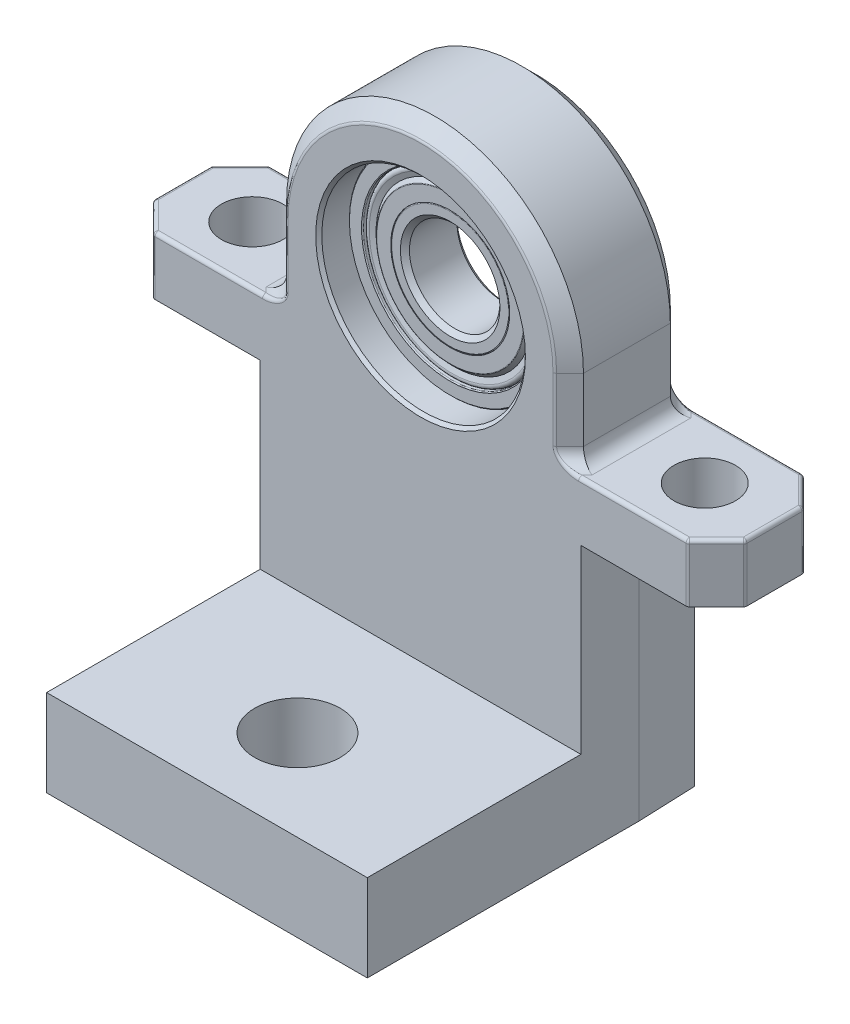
SolidWorks part; units mm, degrees
ref_plane "Front Plane" through (0, 0, 0) normal (0, 0, 1) x (1, 0, 0)
ref_plane "Top Plane" through (0, 0, 0) normal (0, 1, 0) x (1, 0, 0)
ref_plane "Right Plane" through (0, 0, 0) normal (1, 0, 0) x (0, 0, -1)
sketch "Sketch1" plane through (0, 0, 0) normal (0, 0, 1) x (1, 0, 0)
  line L0 (20.828, 0) -> (20.828, -10.922)
  line L1 (20.828, -10.922) -> (41.529, -10.922)
  line L2 (41.529, -10.922) -> (41.529, -19.05)
  line L3 (41.529, -19.05) -> (-41.529, -19.05)
  line L4 (-41.529, -19.05) -> (-41.529, -10.922)
  line L5 (-41.529, -10.922) -> (-20.828, -10.922)
  line L6 (-20.828, -10.922) -> (-20.828, 0)
  circle A0 centre (0, 0) radius 6.35
  arc A1 (20.828, 0) -> (-20.828, 0) centre (0, 0) ccw
  circle A2 centre (0, 0) radius 14.2875
  point P12 (0, 14.2875)
  point P13 (0, 6.35)
sketch "Sketch2" plane through (0, 0, 0) normal (0, 1, 0) x (1, 0, 0)
  line L0 (0, 8.128) -> (0, -8.128) construction
  line L1 (-31.75, 0) -> (31.75, 0) construction
  line L2 (0, -3.9688) -> (0, 3.9688) construction
  circle A0 centre (31.75, 0) radius 4.318 construction
  circle A1 centre (-31.75, 0) radius 4.318 construction
  point P10 (0, 0)
sketch "Sketch3" plane through (0, 0, 0) normal (0, 0, 1) x (1, 0, 0)
  line L0 (20.828, 0) -> (20.828, -10.922) construction
  line L1 (41.529, -10.922) -> (41.529, -19.05) construction
  line L2 (20.828, -10.922) -> (41.529, -10.922) construction
  line L3 (41.529, -19.05) -> (-41.529, -19.05) construction
  line L4 (-41.529, -19.05) -> (-41.529, -10.922) construction
  line L5 (-41.529, -10.922) -> (-20.828, -10.922) construction
  line L6 (-20.828, -10.922) -> (-20.828, 0) construction
  line L7 (20.828, 0) -> (20.828, -10.922)
  line L8 (41.529, -10.922) -> (41.529, -19.05)
  line L9 (20.828, -10.922) -> (41.529, -10.922)
  line L10 (41.529, -19.05) -> (-41.529, -19.05)
  line L11 (-41.529, -19.05) -> (-41.529, -10.922)
  line L12 (-41.529, -10.922) -> (-20.828, -10.922)
  line L13 (-20.828, -10.922) -> (-20.828, 0)
  arc A0 (20.828, 0) -> (-20.828, 0) centre (0, 0) ccw construction
  circle A1 centre (0, 0) radius 14.2875 construction
  arc A2 (20.828, 0) -> (-20.828, 0) centre (0, 0) ccw
  circle A3 centre (0, 0) radius 14.2875
extrude "Extrude1" add sketch "Sketch3" along normal up to vertex (8.128 mm away) and the other way up to vertex (8.128 mm away)
sketch "Sketch4" plane through (0, -10.922, 0) normal (0, 1, 0) x (1, 0, 0)
  line L0 (-41.529, 8.128) -> (-41.529, 4.064)
  line L1 (-41.529, -8.128) -> (-41.529, 8.128) construction
  line L2 (-41.529, 4.064) -> (-37.465, 8.128)
  line L3 (-20.828, 8.128) -> (-41.529, 8.128) construction
  line L4 (-37.465, 8.128) -> (-41.529, 8.128)
  line L5 (0, 0) -> (0, 8.128) construction
  line L6 (0, 0) -> (-31.75, 0) construction
  line L7 (37.465, 8.128) -> (41.529, 8.128)
  line L8 (41.529, 4.064) -> (37.465, 8.128)
  line L9 (41.529, 8.128) -> (41.529, 4.064)
  line L10 (41.529, -8.128) -> (41.529, -4.064)
  line L11 (41.529, -4.064) -> (37.465, -8.128)
  line L12 (37.465, -8.128) -> (41.529, -8.128)
  line L13 (-37.465, -8.128) -> (-41.529, -8.128)
  line L14 (-41.529, -4.064) -> (-37.465, -8.128)
  line L15 (-41.529, -8.128) -> (-41.529, -4.064)
  circle A0 centre (-31.75, 0) radius 4.318 construction
  circle A1 centre (31.75, 0) radius 4.318 construction
  circle A2 centre (-31.75, 0) radius 4.318
  circle A3 centre (31.75, 0) radius 4.318
extrude "Cut-Extrude1" cut sketch "Sketch4" against normal through all
chamfer "Chamfer1" distance 2.032 angle 45 6 edges at (-20.828, -5.461, -8.128) (0, 20.828, -8.128) (20.828, -5.461, -8.128) (-20.828, -5.461, 8.128) (0, 20.828, 8.128) (20.828, -5.461, 8.128)
fillet "Fillet1" radius 2.032 6 edges at (20.828, -10.922, 0) (19.812, -10.922, -7.112) (19.812, -10.922, 7.112) (-19.812, -10.922, -7.112) (-19.812, -10.922, 7.112) (-20.828, -10.922, 0)
fillet "Fillet2" radius 0.508 28 edges at (29.5673, -10.922, -8.128) (19.6377, -10.3268, -8.128) (18.796, -4.445, -8.128) (0, 18.796, -8.128) (-18.796, -4.445, -8.128) (-19.6377, -10.3268, -8.128) (29.5673, -10.922, 8.128) (19.6377, -10.3268, 8.128) (18.796, -4.445, 8.128) (0, 18.796, 8.128) (-18.796, -4.445, 8.128) (-19.6377, -10.3268, 8.128) (39.497, -10.922, 6.096) (41.529, -10.922, 0) (39.497, -10.922, -6.096) (-29.5673, -10.922, -8.128) (-39.497, -10.922, -6.096) (-41.529, -10.922, 0) (-39.497, -10.922, 6.096) (-29.5673, -10.922, 8.128) (-41.529, -14.986, -4.064) (-37.465, -14.986, -8.128) (-41.529, -14.986, 4.064) (-37.465, -14.986, 8.128) (37.465, -14.986, -8.128) (41.529, -14.986, -4.064) (41.529, -14.986, 4.064) (37.465, -14.986, 8.128)
chamfer "Chamfer2" distance 0.4286 angle 45 2 edges at (14.2875, 0, -8.128) (14.2875, 0, 8.128)
sketch "Sketch5" plane through (0, 0, 0) normal (1, 0, 0) x (0, 0, -1)
  line L2 (3.9688, 14.2875) -> (3.9688, 12.3031)
  line L4 (3.9688, 12.3031) -> (-3.9688, 12.3031)
  line L8 (-3.9688, 6.35) -> (3.9688, 6.35)
  line L9 (3.9688, 8.3344) -> (-3.9688, 8.3344)
  line L10 (-3.9688, 14.2875) -> (3.9688, 14.2875)
  line L12 (-3.9688, 8.3344) -> (-3.9688, 6.35)
  line L13 (-3.9688, 14.2875) -> (-3.9688, 12.3031)
  line L17 (0, 14.2875) -> (0, 20.828) construction
  line L18 (0, 20.828) -> (0, 0) construction
  line L24 (3.9688, 8.3344) -> (3.9688, 6.35)
  line L27 (6.096, 20.828) -> (-6.096, 20.828) construction
revolve "Revolve1" add sketch "Sketch5" angle 360 about L0
sketch "Sketch6" plane through (0, 0, 0) normal (1, 0, 0) x (0, 0, -1)
  line L0 (-3.9688, 8.3471) -> (-3.9688, 10.3187)
  line L1 (-3.9316, 10.4086) -> (-2.8932, 11.4469)
  line L2 (-3.6947, 11.6246) -> (-3.4382, 10.9198)
  line L3 (-3.9434, 8.3471) -> (-3.9434, 10.3187)
  line L4 (-3.9136, 10.3906) -> (-2.8753, 11.4289)
  line L5 (-3.7186, 11.6159) -> (-3.4621, 10.9111)
  line L6 (-3.9688, 8.3471) -> (-3.9434, 8.3471)
  line L7 (-3.4382, 10.9198) -> (-3.4621, 10.9111)
  line L8 (3.9688, 12.3031) -> (-3.9688, 12.3031) construction
  line L10 (0, 0) -> (0, 2.6695) construction
  line L11 (3.9688, 8.3471) -> (3.9434, 8.3471)
  line L12 (3.9434, 8.3471) -> (3.9433, 10.3187)
  line L13 (3.9136, 10.3906) -> (2.8753, 11.4289)
  line L14 (3.7186, 11.6159) -> (3.4621, 10.9111)
  line L15 (3.4382, 10.9198) -> (3.4621, 10.9111)
  line L16 (3.6947, 11.6246) -> (3.4382, 10.9198)
  line L17 (3.9316, 10.4086) -> (2.8932, 11.4469)
  line L18 (3.9688, 8.3471) -> (3.9688, 10.3187)
  line L19 (0, 0) -> (1.2184, 0) construction
  line L20 (-3.9688, 8.3344) -> (-3.9688, 6.35) construction
  line L21 (-3.9688, 12.3031) -> (-3.9688, 8.3344) construction
  line L22 (3.9688, 8.3344) -> (-3.9688, 8.3344) construction
  arc A0 (-3.9688, 10.3187) -> (-3.9316, 10.4086) centre (-3.8418, 10.3187) cw
  arc A1 (-2.8932, 11.4469) -> (-3.6947, 11.6246) centre (-3.2374, 11.791) ccw
  arc A2 (-3.9434, 10.3187) -> (-3.9136, 10.3906) centre (-3.8418, 10.3187) cw
  arc A3 (-2.8753, 11.4289) -> (-3.7186, 11.6159) centre (-3.2374, 11.791) ccw
  arc A4 (3.9433, 10.3187) -> (3.9136, 10.3906) centre (3.8418, 10.3187) ccw
  arc A5 (2.8753, 11.4289) -> (3.7186, 11.6159) centre (3.2374, 11.791) cw
  arc A6 (2.8932, 11.4469) -> (3.6947, 11.6246) centre (3.2374, 11.791) cw
  arc A7 (3.9688, 10.3187) -> (3.9316, 10.4086) centre (3.8418, 10.3187) ccw
  point P2 (-3.9688, 10.3187)
revolve "Revolve2" add sketch "Sketch6" angle 360 about L19
chamfer "Chamfer3" distance 0.635 angle 45 2 edges at (-6.35, 0, 3.9688) (-6.35, 0, -3.9687)
fillet "Fillet3" radius 0.127 2 edges at (-8.3344, 0, -3.9687) (-8.3344, 0, 3.9688)
fillet "Fillet4" radius 0.1429 2 edges at (-12.3031, 0, -3.9687) (-12.3031, 0, 3.9688)
chamfer "Chamfer4" distance 0.1429 angle 45 2 edges at (-14.2875, 0, -3.9687) (-14.2875, 0, 3.9688)
sketch "Sketch8" plane through (0, -19.05, 0) normal (0, -1, 0) x (1, 0, 0)
  line L2 (-22.5, 0) -> (-22.5, 38.1)
  line L3 (-22.5, 38.1) -> (22.5, 38.1)
  line L4 (22.5, 38.1) -> (22.5, 0)
  line L5 (-22.5, 0) -> (-22.5, -8.128)
  line L6 (-37.2546, -8.128) -> (37.2546, -8.128) construction
  line L7 (-22.5, -8.128) -> (22.1777, -8.128)
  line L8 (22.1777, -8.128) -> (22.5, 0)
  point P0 (0, 0)
  point P4 (0, 0)
extrude "Boss-Extrude1" add sketch "Sketch8" along normal blind 37.592
sketch "Sketch9" plane through (0, -56.642, 0) normal (0, -1, 0) x (1, 0, 0)
  line L0 (0, 38.1) -> (0, 25.4) construction
  line L1 (22.5, 38.1) -> (-22.5, 38.1) construction
  circle A0 centre (0, 25.4) radius 6
extrude "Cut-Extrude2" cut sketch "Sketch9" against normal blind 16.764
sketch "Sketch10" plane through (0, -19.05, 0) normal (0, 1, 0) x (1, 0, 0)
  line L1 (22.5, -38.1) -> (-22.5, -38.1)
  line L2 (22.5, -38.1) -> (22.5, -8.128)
  line L3 (22.5, -8.128) -> (-22.5, -8.128)
  line L4 (-22.5, -38.1) -> (-22.5, -8.128)
extrude "Cut-Extrude3" cut sketch "Sketch10" against normal blind 25.4
equation "\"D2@Sketch4\" = \"Overall Width@Sketch2\" / 4"
equation "\"D1@Chamfer1\" = \"Overall Width@Sketch2\" / 8"
equation "\"D1@Fillet1\" = \"D1@Chamfer1\""
equation "\"D3@Sketch5\"=\"Bearing Width@Sketch2\""
equation "\"D2@Sketch6\"=\"D3@Sketch6\"*5"
equation "\"D1@Chamfer3\" = \"ID@Sketch1\" * .05"
equation "\"D1@Fillet3\" = \"ID@Sketch1\" * .01"
equation "\"D1@Fillet4\" = \"Bearing OD@Sketch1\" * .005"
equation "\"D1@Chamfer4\" = \"Bearing OD@Sketch1\" * .005"
equation "\"D1@Chamfer2\" = \"Bearing OD@Sketch1\" * .015"
equation "\"D1@Fillet2\" = \"Overall Width@Sketch2\" * .03125"
equation "\"D2@Sketch5\"=(\"Bearing OD@Sketch1\"-\"ID@Sketch1\")/2*.5"
